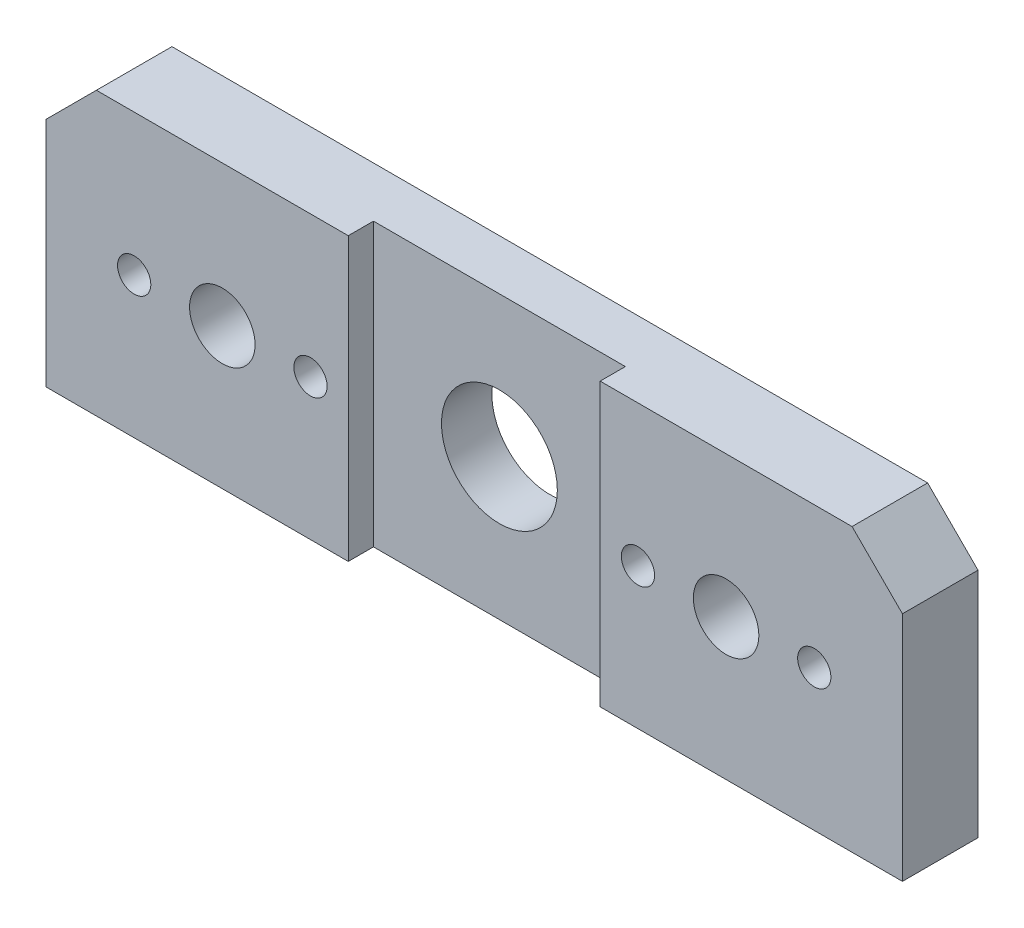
SolidWorks part; units mm, degrees
ref_plane "Face" through (0, 0, 0) normal (0, 0, 1) x (1, 0, 0)
ref_plane "Dessus" through (0, 0, 0) normal (0, 1, 0) x (1, 0, 0)
ref_plane "Droite" through (0, 0, 0) normal (1, 0, 0) x (0, 0, -1)
sketch "Esquisse1" plane through (0, 0, 0) normal (0, 0, 1) x (1, 0, 0)
  line L1 (-85, 0) -> (85, 0)
  line L2 (-85, 0) -> (-85, 56)
  line L3 (-85, 56) -> (85, 56)
  line L4 (85, 0) -> (85, 56)
  dimension "D1" = 170
  dimension "D2" = 85
  dimension "D3" = 56
extrude "Extrusion1" add sketch "Esquisse1" along normal blind 15
chamfer "Chanfrein1" distance 10 angle 45 2 edges at (-85, 56, 7.5) (85, 56, 7.5)
sketch "Esquisse2" plane through (0, 0, 15) normal (0, 0, 1) x (1, 0, 0)
  line L0 (-85, 0) -> (85, 0) construction
  line L1 (-25, 0) -> (25, 0)
  line L2 (-25, 0) -> (-25, 84.0865)
  line L3 (-25, 84.0865) -> (25, 84.0865)
  line L4 (25, 0) -> (25, 84.0865)
  dimension "D1" = 50
  dimension "D2" = 25
extrude "Enlèv. mat.-Extru.1" cut sketch "Esquisse2" against normal blind 5
sketch "Esquisse3" plane through (0, 0, 15) normal (0, 0, 1) x (1, 0, 0)
  line L0 (-85.5821, 28) -> (104.2738, 28) construction
  line L1 (0, 0) -> (0, 67.0027) construction
  line L2 (-25, 56) -> (-75, 56) construction
  circle A0 centre (0, 28) radius 11.5
  circle A1 centre (-50, 28) radius 6.5
  circle A2 centre (50, 28) radius 6.5
  dimension "D1" = 23
  dimension "D2" = 13
  dimension "D3" = 100
  dimension "D4" = 50
  dimension "D5" = 28
extrude "Enlèv. mat.-Extru.2" cut sketch "Esquisse3" against normal through all
hole_wizard "Chambrage pour vis à tête cylindrique à 6 pans creux (vis CHC) M61" positions "Esquisse5" profile "Esquisse4" counterbore size "M6" standard "ISO"
sketch "Esquisse5" plane through (0, 0, 0) normal (0, 0, -1) x (-1, 0, 0)
  line L0 (0, 28) -> (100.2465, 28) construction
  line L1 (0, 28) -> (-98.3125, 28) construction
  circle A0 centre (-50, 28) radius 6.5 construction
  circle A1 centre (50, 28) radius 6.5 construction
  point P0 (-32.5, 28)
  point P1 (-67.5, 28)
  point P2 (32.5, 28)
  point P3 (67.5, 28)
  dimension "D1" = 35
  dimension "D2" = 35
  dimension "D3" = 17.5
  dimension "D4" = 17.5
sketch "Esquisse4" plane through (32.5, 28, 0) normal (1, 0, 0) x (0, 1, 0)
  line L0 (0, 0) -> (0, 15)
  line L1 (0, 15) -> (3.3, 15)
  line L3 (3.3, 15) -> (3.3, 7)
  line L4 (3.3, 7) -> (6, 7)
  line L5 (6, 7) -> (6, 0)
  line L7 (6, 0) -> (0, 0)
  line L11 (0, -6.35) -> (0, 107.95) construction
  dimension "Diamètre du perçage jusqu'au prochain" = 6.6
  dimension "Profondeur du perçage jusqu'au prochain" = 15
  dimension "Diamètre du chambrage" = 12
  dimension "Profondeur du chambrage" = 7
hole_wizard "Trou taraudé M6x1.01" positions "Esquisse7" profile "Esquisse6" tap size "M6x1.0" standard "ISO"
sketch "Esquisse7" plane through (0, 0, 0) normal (0, -1, 0) x (1, 0, 0)
  line L0 (89.9317, 7.5) -> (-95.0891, 7.5) construction
  line L1 (-85, 0) -> (85, 0) construction
  line L2 (85, 15) -> (85, 0) construction
  line L3 (-85, 15) -> (-85, 0) construction
  point P0 (73, 7.5)
  point P1 (-73, 7.5)
  dimension "D1" = 7.5
  dimension "D2" = 12
  dimension "D3" = 12
sketch "Esquisse6" plane through (73, 0, 7.5) normal (1, 0, 0) x (0, 0, -1)
  line L0 (0, 0) -> (0, 24.4421)
  line L1 (0, 24.4421) -> (2.4, 23)
  line L2 (2.4, 23) -> (2.4, 0)
  line L5 (2.4, 0) -> (0, 0)
  line L10 (0, 24.4421) -> (-2.4, 23) construction
  line L11 (0, -6.35) -> (0, 107.95) construction
  dimension "Diamètre du trou pour taraudage" = 4.8
  dimension "Profondeur du trou pour taraudage" = 23
  dimension "Angle de pointe" = 118
